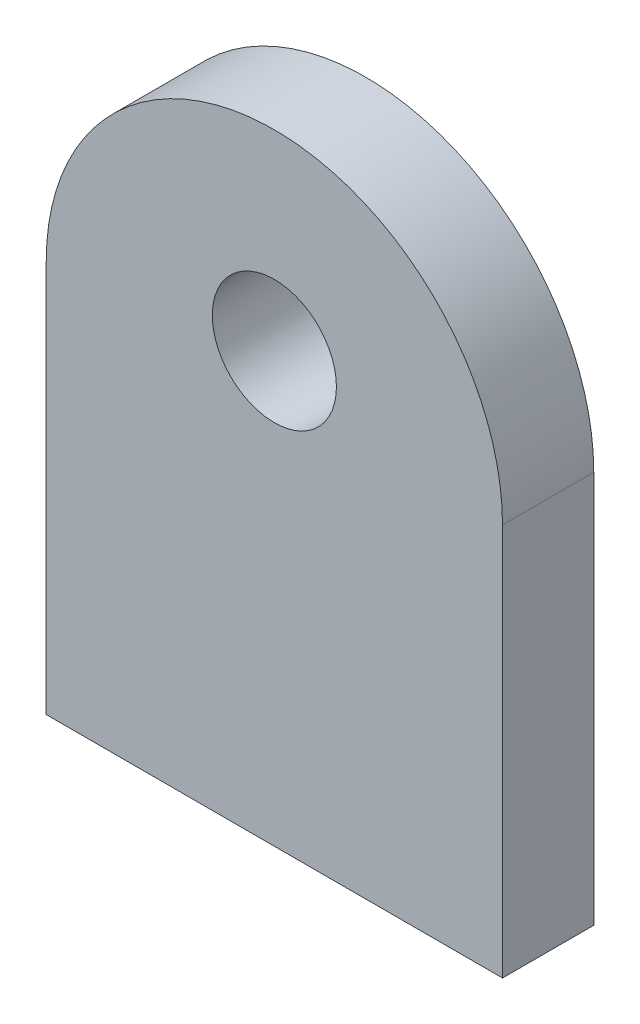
SolidWorks part; units mm, degrees
ref_plane "Plan de face" through (0, 0, 0) normal (0, 0, 1) x (1, 0, 0)
ref_plane "Plan de dessus" through (0, 0, 0) normal (0, 1, 0) x (1, 0, 0)
ref_plane "Plan de droite" through (0, 0, 0) normal (1, 0, 0) x (0, 0, -1)
sketch "Esquisse1" plane through (0, 0, 0) normal (0, 0, 1) x (1, 0, 0)
  line L0 (-12.5, 0) -> (12.5, 0)
  line L1 (12.5, 0) -> (12.5, 21.5)
  line L2 (-12.5, 21.5) -> (-12.5, 0)
  arc A0 (12.5, 21.5) -> (-12.5, 21.5) centre (0, 21.5) ccw
  point P6 (0, 0)
  dimension "D2" = 34
  dimension "D1" = 25
extrude "Boss.-Extru.1" add sketch "Esquisse1" along normal blind 5
hole_wizard "Trou taraudé M81" positions "Esquisse3" profile "Esquisse2" tap size "M8" standard "ISO"
sketch "Esquisse3" plane through (0, 0, 5) normal (0, 0, 1) x (1, 0, 0)
  arc A0 (12.5, 21.5) -> (-12.5, 21.5) centre (0, 21.5) ccw construction
  point P0 (0, 23.5)
  dimension "D1" = 2
sketch "Esquisse2" plane through (0, 23.5, 5) normal (1, 0, 0) x (0, -1, 0)
  line L0 (0, 0) -> (0, 5)
  line L1 (0, 5) -> (3.4, 5)
  line L2 (3.4, 5) -> (3.4, 0)
  line L5 (3.4, 0) -> (0, 0)
  line L11 (0, -6.35) -> (0, 107.95) construction
  dimension "Diamètre du trou pour taraudage jusqu'au prochain" = 6.8
  dimension "Profondeur du trou pour taraudage jusqu'au prochain" = 5
